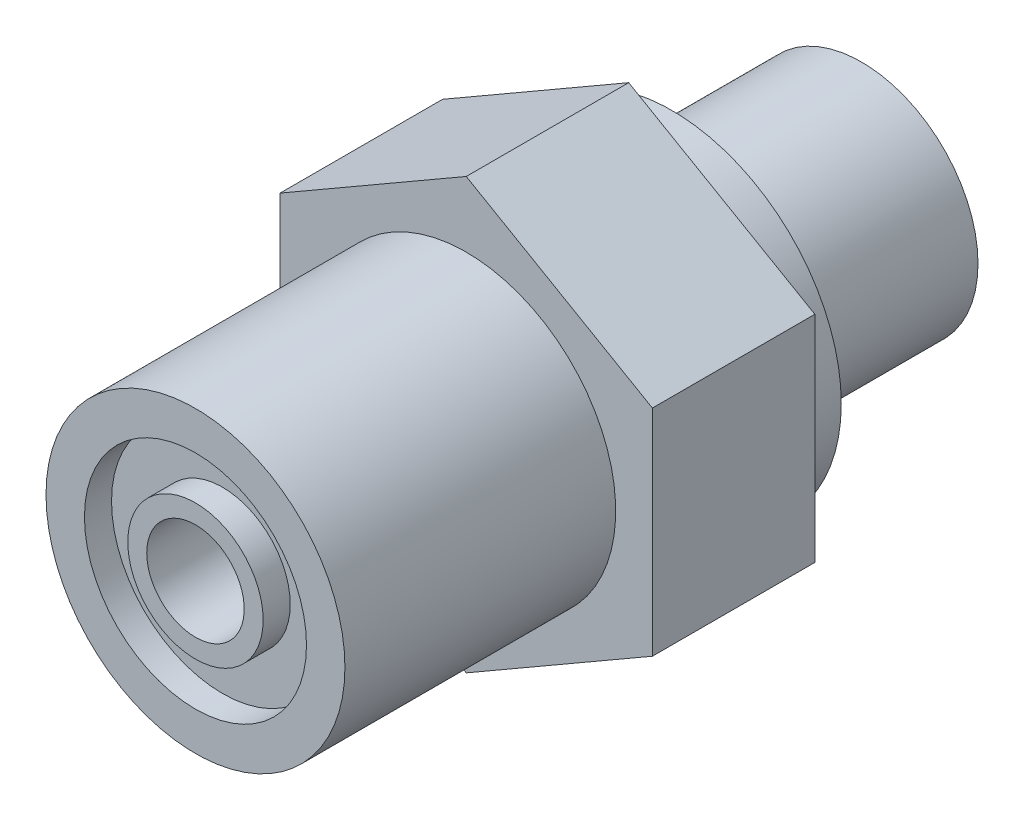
SolidWorks part; units mm, degrees
ref_plane "Front Plane" through (0, 0, 0) normal (0, 0, 1) x (1, 0, 0)
ref_plane "Top Plane" through (0, 0, 0) normal (0, 1, 0) x (1, 0, 0)
ref_plane "Right Plane" through (0, 0, 0) normal (1, 0, 0) x (0, 0, -1)
sketch "Sketch1" plane through (0, 0, 0) normal (0, 0, 1) x (1, 0, 0)
  circle A0 centre (0, 0) radius 5.461
  dimension "D1" = 10.922
extrude "Extrude1" add sketch "Sketch1" along normal blind 8.89
sketch "Sketch2" plane through (0, 0, 8.89) normal (0, 0, 1) x (1, 0, 0)
  circle A0 centre (0, 0) radius 7.9375
  dimension "D1" = 15.875
extrude "Extrude2" add sketch "Sketch2" along normal blind 2.032
sketch "Sketch21" plane through (1.5246, -1.8905, 10.922) normal (0, 0, 1) x (1, 0, 0)
  line L0 (7.2066, 6.9315) -> (7.2066, -3.1505)
  line L1 (-10.2559, 1.8905) -> (7.2066, 1.8905) construction
  line L2 (-1.5246, -8.1915) -> (7.2066, -3.1505)
  line L3 (-1.5246, -8.1915) -> (-1.5246, 11.9725) construction
  line L4 (-1.5246, 11.9725) -> (-10.2558, 6.9315)
  line L5 (-1.5246, 11.9725) -> (7.2066, 6.9315)
  line L6 (-1.5246, -8.1915) -> (-10.2558, -3.1505)
  line L7 (-10.2558, 6.9315) -> (-10.2558, -3.1505)
  dimension "D1" = 8.7312
  dimension "D2" = 10.082
  dimension "D3" = 5.041
  dimension "D4" = 10.082
  dimension "D5" = 10.082
  dimension "flat" = 17.4625
extrude "Boss-Extrude1" add sketch "Sketch21" along normal blind 7.62
other "hex_nut1"
sketch "Sketch22" plane through (0, 0, 18.542) normal (0, 0, 1) x (1, 0, 0)
  circle A0 centre (0, 0) radius 7.0104
  dimension "D1" = 14.0208
extrude "Extrude4" add sketch "Sketch22" along normal blind 12.7
sketch "Sketch23" plane through (0, 0, 0) normal (0, 0, -1) x (-1, 0, 0)
  circle A0 centre (0, 0) radius 2.286
  dimension "D1" = 4.572
extrude "Cut-Extrude1" cut sketch "Sketch23" against normal through all
sketch "Sketch24" plane through (0, 0, 31.242) normal (0, 0, 1) x (1, 0, 0)
  circle A0 centre (0, 0) radius 3.175
  circle A1 centre (0, 0) radius 5.207
  dimension "D1" = 6.35
  dimension "D2" = 10.414
extrude "Cut-Extrude2" cut sketch "Sketch24" against normal blind 1.27
equation "\"D5@Sketch21\" = \"flat@Sketch21\" * .57735"
equation "\"D4@Sketch21\" = \"D5@Sketch21\""
equation "\"D1@Sketch21\" = \"flat@Sketch21\"/2"
equation "\"D2@Sketch21\" = \"D5@Sketch21\""
equation "\"D3@Sketch21\" = \"D2@Sketch21\"/2"
